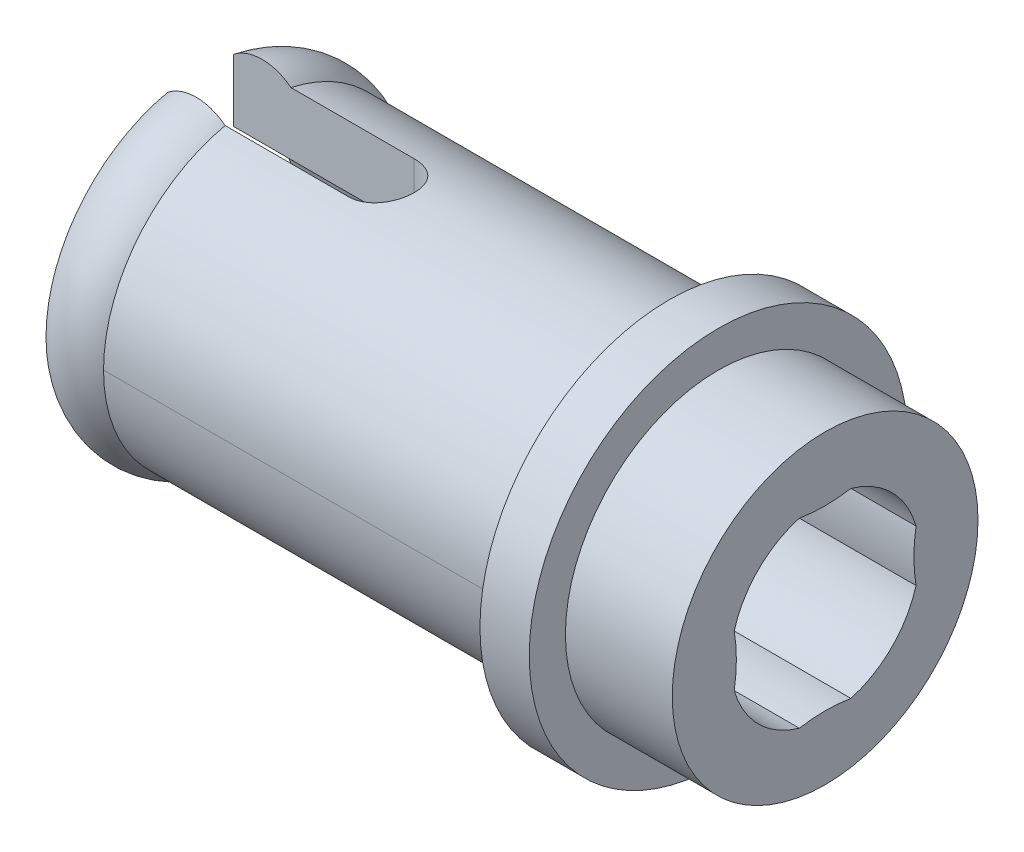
SolidWorks part; units mm, degrees
ref_plane "Front" through (0, 0, 0) normal (0, 0, 1) x (1, 0, 0)
ref_plane "Top" through (0, 0, 0) normal (0, 1, 0) x (1, 0, 0)
ref_plane "Right" through (0, 0, 0) normal (1, 0, 0) x (0, 0, -1)
sketch "Sketch1" plane through (0, 0, 0) normal (1, 0, 0) x (0, 0, -1)
  circle A0 centre (0, 0) radius 2.3622
  dimension "D1" = 4.7244
extrude "Base-Extrude" add sketch "Sketch1" along normal blind 1.651
sketch "Sketch3" plane through (0, 0, 0) normal (-1, 0, 0) x (0, 0, 1)
  circle A0 centre (0, 0) radius 2.921
  dimension "D1" = 5.842
extrude "Boss-Extrude1" add sketch "Sketch3" along normal blind 0.762
sketch "Sketch4" plane through (-0.762, 0, 0) normal (-1, 0, 0) x (0, 0, 1)
  circle A0 centre (0, 0) radius 2.3876
  dimension "D1" = 4.7752
extrude "Boss-Extrude2" add sketch "Sketch4" along normal blind 7.239
ref_plane "Plane1" through (-0.508, 0, 0) normal (1, 0, 0) x (0, 0, -1)
sketch "Sketch6" plane through (0, 0, 0) normal (0, 1, 0) x (1, 0, 0)
  line L0 (-0.762, 2.3876) -> (-8.001, 2.3876) construction
  line L1 (0, 0) -> (-8.8014, 0) construction
  line L2 (-8.001, 2.3876) -> (-7.112, 2.3876)
  arc A0 (-8.001, 2.3876) -> (-7.112, 2.3876) centre (-7.5565, 1.8156) cw
  dimension "D1" = 0.889
  dimension "D2" = 5.08
revolve "Boss-Revolve2" add sketch "Sketch6" angle 360 about L1
sketch "Sketch7" plane through (-8.001, 0, 0) normal (-1, 0, 0) x (0, 0, 1)
  circle A0 centre (0, 0) radius 1.4605
  dimension "D1" = 2.921
extrude "Cut-Extrude2" cut sketch "Sketch7" against normal through all
sketch "Sketch8" plane through (0, 0, 0) normal (0, 1, 0) x (1, 0, 0)
  line L0 (0, 0) -> (-8.8999, 0) construction
  line L1 (-8.001, 0.508) -> (-5.207, 0.508)
  line L3 (-5.207, -0.508) -> (-8.001, -0.508)
  line L4 (-8.001, -0.508) -> (-8.001, 0.508)
  line L5 (-8.001, -2.3876) -> (-8.001, 2.3876) construction
  arc A0 (-5.207, 0.508) -> (-5.207, -0.508) centre (-5.207, 0) cw
  dimension "D1" = 1.016
  dimension "D2" = 2.794
extrude "Cut-Extrude4" cut sketch "Sketch8" against normal through all and the other way through all
sketch "Sketch11" plane through (1.651, 0, 0) normal (1, 0, 0) x (0, 0, -1)
  line L0 (0, 0) -> (3.0369, 0) construction
  line L1 (0, 0) -> (0, 3.3772) construction
  circle A0 centre (0, 0) radius 1.4605 construction
  arc A1 (0.3985, 1.4051) -> (-0.3985, 1.4051) centre (0, 0) ccw
  arc A2 (0.3985, 1.4051) -> (-0.3985, 1.4051) centre (0, 3.7592) cw
  dimension "D1" = 4.7752
  dimension "D2" = 3.7592
extrude "Boss-Extrude11" add sketch "Sketch11" against normal blind 3.937
pattern_circular "CirPattern1" count 4 every 90 about axis through (0, 0, 0) along (1, 0, 0) of "Boss-Extrude11"
